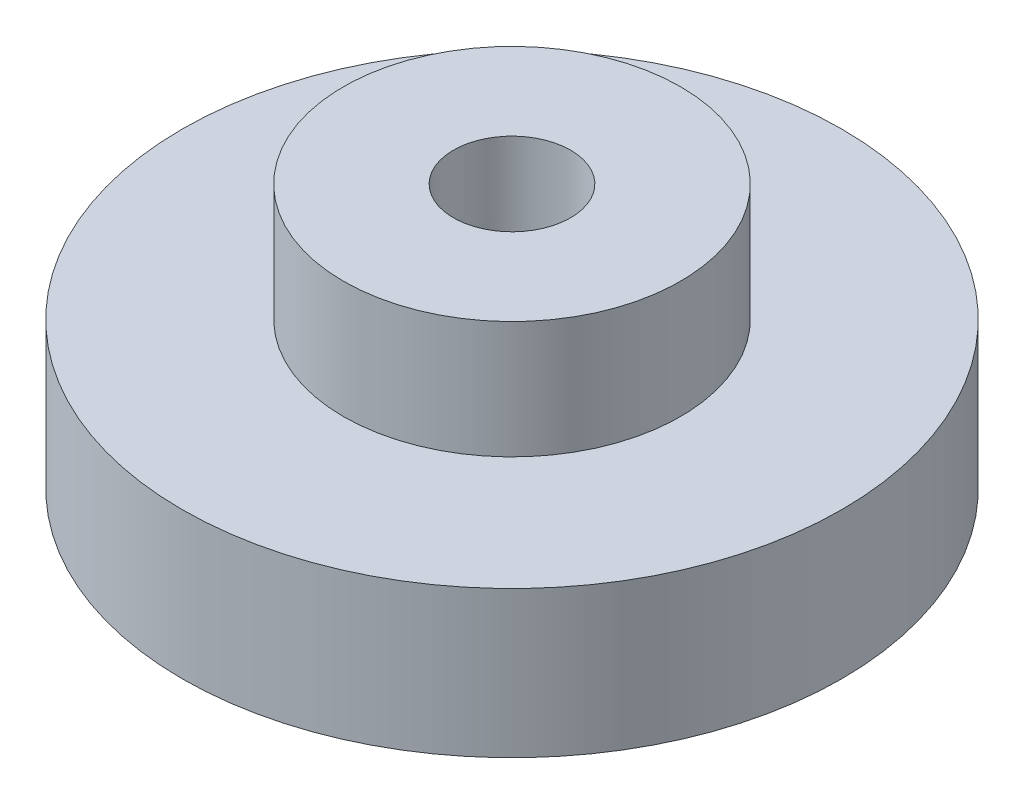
SolidWorks part; units mm, degrees
ref_plane "Front Plane" through (0, 0, 0) normal (0, 0, 1) x (1, 0, 0)
ref_plane "Top Plane" through (0, 0, 0) normal (0, 1, 0) x (1, 0, 0)
ref_plane "Right Plane" through (0, 0, 0) normal (1, 0, 0) x (0, 0, -1)
sketch "Sketch1" plane through (0, 0, 0) normal (0, 1, 0) x (1, 0, 0)
  circle A0 centre (0, 0) radius 22.5
  dimension "D1" = 45
extrude "Boss-Extrude1" add sketch "Sketch1" along normal blind 10
sketch "Sketch2" plane through (0, 10, 0) normal (0, 1, 0) x (1, 0, 0)
  circle A0 centre (0, 0) radius 11.5
  dimension "D1" = 23
extrude "Boss-Extrude2" add sketch "Sketch2" along normal blind 8
sketch "Sketch3" plane through (0, 0, 0) normal (0, -1, 0) x (1, 0, 0)
  circle A0 centre (0, 0) radius 4
  dimension "D1" = 8
extrude "Cut-Extrude1" cut sketch "Sketch3" against normal through all both and the other way through all
